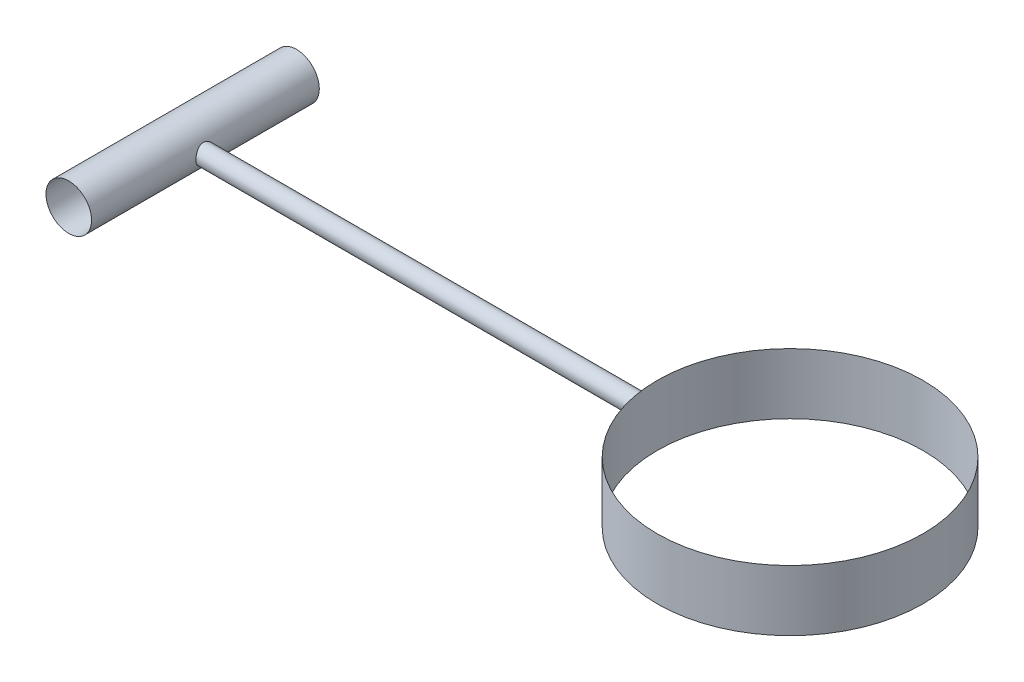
SolidWorks part; units mm, degrees
ref_plane "Plan de face" through (0, 0, 0) normal (0, 0, 1) x (1, 0, 0)
ref_plane "Plan de dessus" through (0, 0, 0) normal (0, 1, 0) x (1, 0, 0)
ref_plane "Plan de droite" through (0, 0, 0) normal (1, 0, 0) x (0, 0, -1)
sketch "Esquisse1" plane through (0, 0, 0) normal (0, 0, 1) x (1, 0, 0)
  line L0 (0, 0) -> (0, 28.8776) construction
  line L1 (-35, 8) -> (-35, -8)
  dimension "D1" = 8
  dimension "D2" = 16
  dimension "D3" = 70
surface "Surface-Révolution1" sketch "Esquisse1" parameters "D1"=360
sketch "Esquisse2" plane through (0, 0, 0) normal (0, 0, 1) x (1, 0, 0)
  circle A0 centre (-160, 0) radius 6
  dimension "D1" = 12
  dimension "D2" = 160
surface "Surface-Extrusion1" sketch "Esquisse2" parameters "D1"=60
ref_plane "Plan1" through (-60, 0, 0) normal (1, 0, 0) x (0, 0, -1)
sketch "Esquisse3" plane through (-60, 0, 0) normal (1, 0, 0) x (0, 0, -1)
  circle A0 centre (0, 0) radius 2.5
  dimension "D1" = 5
surface "Surface-Extrusion2" sketch "Esquisse3"
